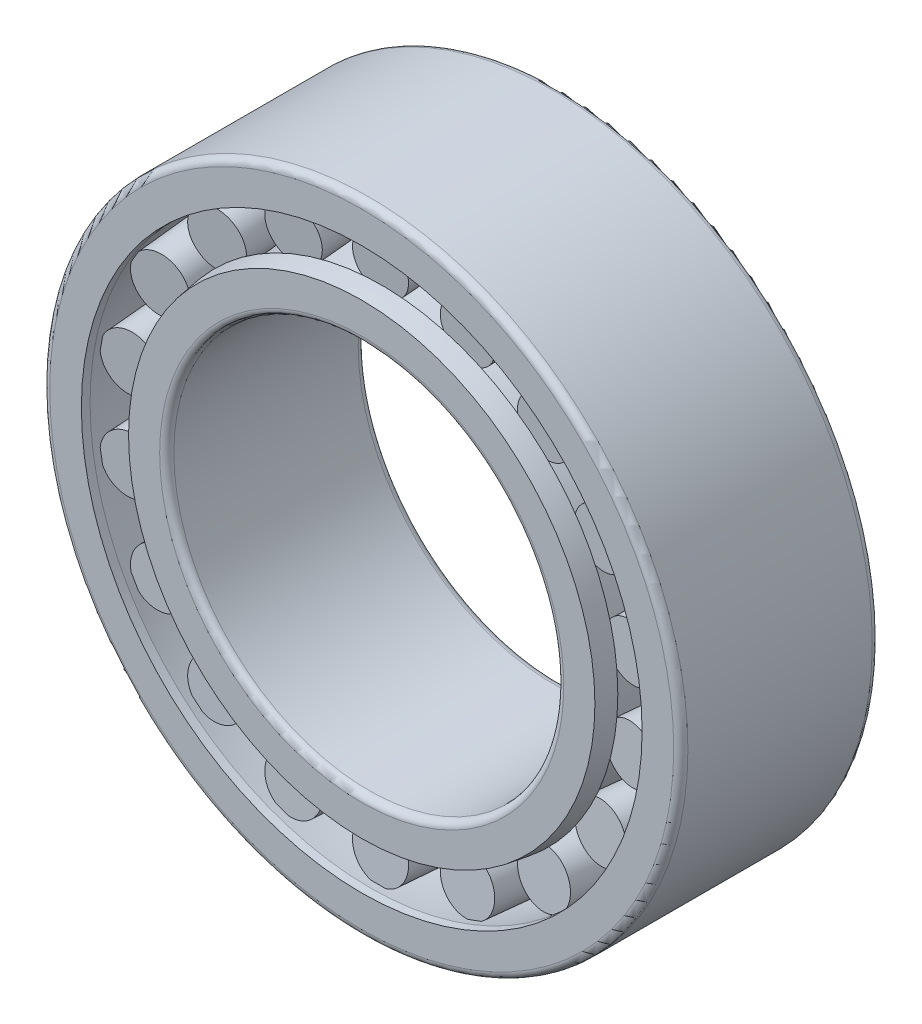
SolidWorks part; units mm, degrees
ref_plane "Front Plane" through (0, 0, 0) normal (0, 0, 1) x (1, 0, 0)
ref_plane "Top Plane" through (0, 0, 0) normal (0, 1, 0) x (1, 0, 0)
ref_plane "Right Plane" through (0, 0, 0) normal (1, 0, 0) x (0, 0, -1)
other "Configuration Table"
sketch "BaseSke" plane through (0, 0, 0) normal (1, 0, 0) x (0, 0, -1)
  line L0 (-47.2296, 0) -> (69.4868, 0) construction
  line L2 (0, 129.5214) -> (0, 80.8742) construction
  line L3 (-28, 55) -> (-28, 65.7692) construction
  line L4 (-28, 90) -> (28, 90) construction
  line L5 (-28, 55) -> (28, 55) construction
  line L7 (28, 55) -> (28, 65.7692) construction
  line L8 (28, 78.6923) -> (28, 90) construction
  line L9 (-28, 78.6923) -> (-28, 90) construction
  line L11 (0, 74.4966) -> (-28, 72.2308) construction
  line L12 (0, 74.4966) -> (28, 72.2308) construction
  line L13 (-28, 78.6923) -> (-28, 65.7692) construction
  line L14 (0, 68.119) -> (0, -86.3012) construction
  line L15 (0, 80.8742) -> (0, 68.119) construction
  line L16 (-22.6978, 71.7234) -> (-22.0623, 63.8701) construction
  line L17 (-23.3333, 79.5768) -> (-4.7275, 81.0825)
  line L18 (-23.3333, 79.5768) -> (-22.6978, 71.7234)
  line L19 (-22.0623, 63.8701) -> (-3.4565, 65.3757) construction
  line L20 (-4.7275, 81.0825) -> (-4.092, 73.2291)
  line L21 (-3.4565, 65.3757) -> (-4.092, 73.2291) construction
  line L22 (-22.6978, 71.7234) -> (-4.092, 73.2291)
  line L23 (-28, 71.2944) -> (0, 73.5602) construction
  arc A1 (-28, 78.6923) -> (28, 78.6923) centre (0, -99.881) cw construction
  arc A2 (28, 65.7692) -> (-28, 65.7692) centre (0, -99.881) ccw construction
revolve "Roller" add sketch "BaseSke" angle 360 about L23
sketch "OuterRaceSke" plane through (0, 0, 0) normal (1, 0, 0) x (0, 0, -1)
  line L0 (0, 0) -> (0, 94.5438) construction
  line L1 (-28, 90) -> (28, 90)
  line L2 (-28, 90) -> (-28, 78.6721)
  line L3 (28, 90) -> (28, 78.6721)
  line L5 (-50.3916, 0) -> (55.2197, 0) construction
  arc A0 (-28, 78.6721) -> (28, 78.6721) centre (0, -99.881) cw
  arc A2 (28, 78.6923) -> (-28, 78.6923) centre (0, -99.881) ccw construction
  dimension "D1" = 0.02
revolve "OuterRace" add sketch "OuterRaceSke" angle 360 about L5
sketch "InnerRaceSke" plane through (0, 0, 0) normal (1, 0, 0) x (0, 0, -1)
  line L0 (-70.8626, 0) -> (113.5527, 0) construction
  line L1 (0, 90.393) -> (0, -90.393) construction
  line L2 (-28, 55) -> (28, 55)
  line L3 (-28, 55) -> (-28, 65.7692)
  line L4 (-22.3852, 66.621) -> (-22.1636, 63.8819)
  line L5 (-22.1636, 63.8819) -> (-3.3584, 65.4037)
  line L7 (-3.3584, 65.4037) -> (-3.5751, 68.081)
  line L8 (-22.6978, 71.7234) -> (-22.0623, 63.8701) construction
  line L9 (3.3584, 65.4037) -> (3.5751, 68.081)
  line L10 (-3.4565, 65.3757) -> (-4.092, 73.2291) construction
  line L11 (-22.0623, 63.8701) -> (-3.4565, 65.3757) construction
  line L14 (22.1636, 63.8819) -> (3.3584, 65.4037)
  line L15 (22.3852, 66.621) -> (22.1636, 63.8819)
  line L16 (28, 55) -> (28, 65.7692)
  arc A0 (-28, 65.7692) -> (-22.3852, 66.621) centre (0, -99.881) cw
  arc A1 (28, 65.7692) -> (-28, 65.7692) centre (0, -99.881) ccw construction
  arc A2 (-3.5751, 68.081) -> (3.5751, 68.081) centre (0, -99.881) cw
  arc A3 (28, 65.7692) -> (22.3852, 66.621) centre (0, -99.881) ccw
  point P38 (0, 55)
  dimension "D2" = 0.1
  dimension "D1" = 0.02
  dimension "D3" = 0.1
revolve "InnerRace" add sketch "InnerRaceSke" angle 360 about L0
mirror "MirrorRoller" about plane through (0, 0, 0) normal (0, 0, 1) of "Roller"
fillet "Fillet1" radius 2 4 edges at (55, 0, 28) (90, 0, 28) (55, 0, -28) (90, 0, -28)
sketch "CutGrooveSke" plane through (0, 0, 0) normal (1, 0, 0) x (0, 0, -1)
  line L0 (-51.8407, 0) -> (83.8302, 0) construction
  line L1 (-14, -108.2) -> (-16.8, -108.2)
  line L2 (-14, -108.2) -> (-14, -88.2)
  line L3 (-14, -88.2) -> (-16.8, -88.2)
  line L4 (-16.8, -108.2) -> (-16.8, -88.2)
revolve "CutGroove" [suppressed] cut sketch "CutGrooveSke" angle 360 about L0
sketch "TaperSke" plane through (0, 0, 0) normal (1, 0, 0) x (0, 0, -1)
  line L0 (-28, 55) -> (28, 55)
  line L1 (28, 55) -> (28, 59.6667)
  line L2 (28, 59.6667) -> (-28, 55)
  line L7 (-41.2502, 0) -> (40.8606, 0) construction
revolve "Taper" [suppressed] cut sketch "TaperSke" angle 360 about L7
fillet "Fillet2" [suppressed] radius 2
pattern_circular "CirPatternBall" count 18 over 360 about axis through (0, 0, 0) along (0, 0, 1) of "Roller", "MirrorRoller"
sketch "SimplifiedSke" plane through (0, 0, 0) normal (1, 0, 0) x (0, 0, -1)
  line L0 (37.5911, 0) -> (-37.5911, 0) construction
  line L1 (0, 0) -> (0, 96.8272) construction
  line L2 (-22.0623, 63.8701) -> (-3.4565, 65.3757)
  line L3 (-22.0623, 63.8701) -> (-23.3333, 79.5768)
  line L4 (-23.3333, 79.5768) -> (-4.7275, 81.0825)
  line L5 (-3.4565, 65.3757) -> (-4.7275, 81.0825)
  line L7 (3.4565, 65.3757) -> (4.7275, 81.0825)
  line L8 (22.0623, 63.8701) -> (3.4565, 65.3757)
  line L9 (22.0623, 63.8701) -> (23.3333, 79.5768)
  line L10 (23.3333, 79.5768) -> (4.7275, 81.0825)
revolve "Simplified" [suppressed] add sketch "SimplifiedSke" angle 360 about L0
chamfer "Chamfer" distance 2.3333 angle 10 2 edges at (78.6721, 0, -28) (78.6721, 0, 28)
equation "\"D1@BaseSke\" = \"Bearing_Thickness@BaseSke\"*3"
equation "\"D2@BaseSke\" =  ( \"Bearing_Outside_Diameter@BaseSke\" - \"Bearing_Inside_Diameter@BaseSke\" ) /6.5"
equation "\"D3@BaseSke\" = \"D2@BaseSke\"*1.05"
equation "\"D4@BaseSke\" = \"Bearing_Thickness@BaseSke\"/3"
equation "\"D5@BaseSke\" = \"Bearing_Thickness@BaseSke\"/12"
equation "\"D6@BaseSke\" = \"Bearing_Thickness@BaseSke\"/60"
equation "\"D1@CutGrooveSke\" = \"Bearing_Outside_Diameter@BaseSke\" * 0.49"
equation "\"D2@CutGrooveSke\" = \"Bearing_Thickness@BaseSke\" *0.25"
equation "\"D3@CutGrooveSke\" = \"Bearing_Thickness@BaseSke\"/20"
equation "\"Taper@TaperSke\" = \"Bearing_Thickness@BaseSke\"/12"
equation "\"D1@Fillet2\" = \"Fillet_radius@Fillet1\""
equation "\"D1@CirPatternBall\" =  int(  ( \"Bearing_Outside_Diameter@BaseSke\" + \"Bearing_Inside_Diameter@BaseSke\" )  / 2 *  pi  /  ( \"Bearing_Outside_Diameter@BaseSke\" - \"Bearing_Inside_Diameter@BaseSke\" ) * 2.8 "
equation "\"D1@Chamfer\" = \"Bearing_Thickness@BaseSke\"/24"
